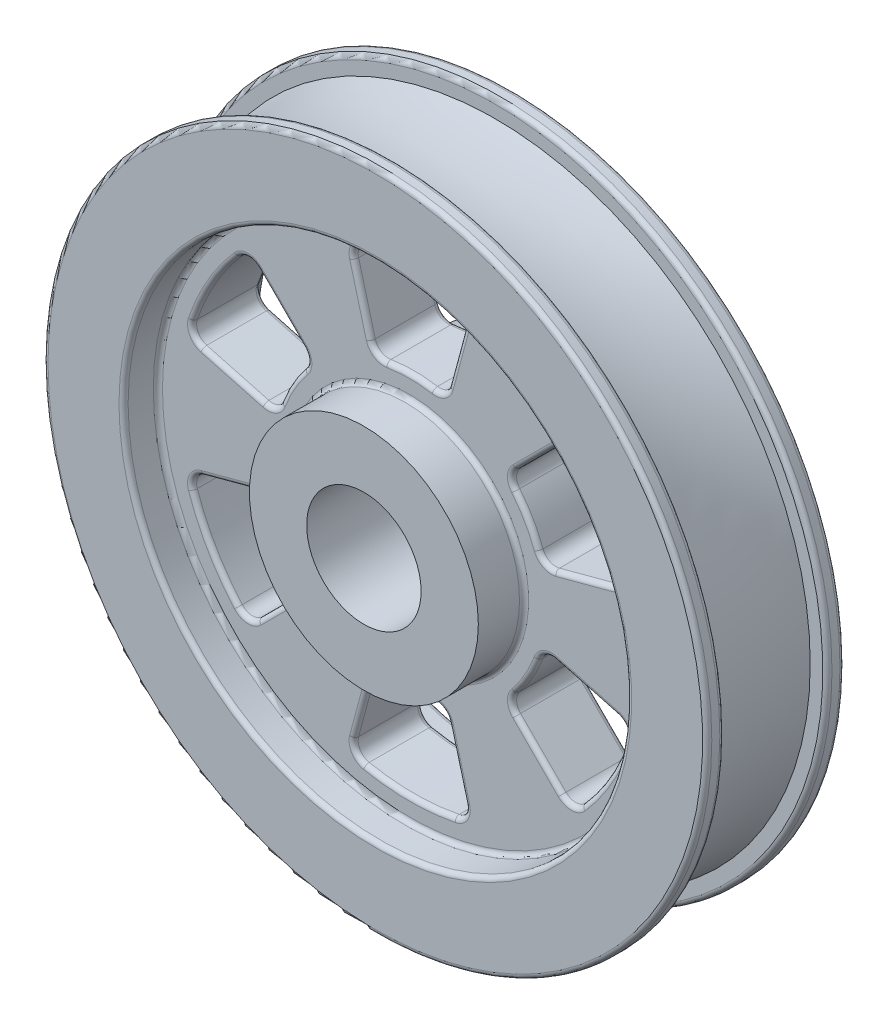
SolidWorks part; units mm, degrees
ref_plane "Front Plane" through (0, 0, 0) normal (0, 0, 1) x (1, 0, 0)
ref_plane "Top Plane" through (0, 0, 0) normal (0, 1, 0) x (1, 0, 0)
ref_plane "Right Plane" through (0, 0, 0) normal (1, 0, 0) x (0, 0, -1)
sketch "Wheel Cross-section" plane through (0, 0, 0) normal (1, 0, 0) x (0, 0, -1)
  line L0 (-130.7747, 0) -> (134.6553, 0) construction
  line L1 (44.45, 31.75) -> (44.45, 63.5)
  line L2 (44.45, 63.5) -> (19.05, 63.5)
  line L3 (19.05, 63.5) -> (19.05, 139.7)
  line L4 (19.05, 139.7) -> (38.1, 139.7)
  line L5 (38.1, 139.7) -> (38.1, 184.15)
  line L6 (38.1, 184.15) -> (28.575, 184.15)
  line L7 (28.575, 184.15) -> (28.575, 174.625)
  line L9 (-28.575, 174.625) -> (-28.575, 184.15)
  line L10 (-28.575, 184.15) -> (-38.1, 184.15)
  line L11 (-38.1, 184.15) -> (-38.1, 139.7)
  line L12 (-38.1, 139.7) -> (-19.05, 139.7)
  line L13 (-19.05, 139.7) -> (-19.05, 63.5)
  line L14 (-19.05, 63.5) -> (-44.45, 63.5)
  line L15 (-44.45, 63.5) -> (-44.45, 31.75)
  line L17 (-44.45, 31.75) -> (44.45, 31.75)
  arc A0 (28.575, 174.625) -> (-28.575, 174.625) centre (0, 324.3221) cw
  dimension "D13" = 152.4
  dimension "D14" = 9.525
  dimension "D1" = 44.45
  dimension "D2" = 88.9
  dimension "D3" = 25.4
  dimension "D4" = 38.1
  dimension "D5" = 63.5
  dimension "D6" = 76.2
  dimension "D7" = 9.525
  dimension "D8" = 9.525
  dimension "D9" = 31.75
  dimension "D10" = 6.35
  dimension "D11" = 139.7
  dimension "D12" = 184.15
revolve "Revolve1" add sketch "Wheel Cross-section" angle 360 about L0
sketch "Spoke cut-out" plane through (0, 0, 19.05) normal (0, 0, 1) x (1, 0, 0)
  line L0 (0, 0) -> (-60.1063, 224.3199) construction
  line L1 (0, 0) -> (0, 216.2459) construction
  line L2 (0, 0) -> (59.3665, 221.5588) construction
  line L3 (30.8348, 115.0771) -> (21.6044, 80.6286)
  line L4 (-30.8348, 115.0771) -> (-21.6044, 80.6286)
  circle A0 centre (0, 0) radius 127 construction
  circle A1 centre (0, 0) radius 76.2 construction
  arc A2 (24.9728, 124.5205) -> (-24.9728, 124.5205) centre (0, 0) ccw
  arc A3 (12.9491, 75.0917) -> (-12.9491, 75.0917) centre (0, 0) ccw
  arc A4 (24.9728, 124.5205) -> (30.8348, 115.0771) centre (23.4745, 117.0493) cw
  arc A5 (-24.9728, 124.5205) -> (-30.8348, 115.0771) centre (-23.4745, 117.0493) ccw
  arc A6 (-12.9491, 75.0917) -> (-21.6044, 80.6286) centre (-14.244, 82.6008) cw
  arc A7 (12.9491, 75.0917) -> (21.6044, 80.6286) centre (14.244, 82.6008) ccw
  point P13 (32.87, 122.6726)
  point P16 (-32.87, 122.6726)
  point P19 (-19.722, 73.6035)
  point P22 (19.722, 73.6035)
  dimension "D1" = 254
  dimension "D2" = 152.4
  dimension "D5" = 7.62
  dimension "D6" = 7.62
  dimension "D7" = 7.62
  dimension "D3" = 15
  dimension "D4" = 15
extrude "Spoke hole" cut sketch "Spoke cut-out" against normal through all
pattern_circular "Spoke hole pattern" count 6 over 360 about axis through (0, 0, 0) along (0, 0, 1) of "Spoke hole"
fillet "0.10 inch Fillets & Rounds" radius 2.54 106 edges at (184.15, 0, -38.1) (-119.8223, -34.5978, 19.05) (-109.9852, -63.5, 19.05) (-89.8737, -86.4702, 19.05) (-71.6333, -71.6333, 19.05) (-56.8003, -53.9828, 19.05) (-65.9911, -38.1, 19.05) (-75.1507, -22.1991, 19.05) (-97.8529, -26.2196, 19.05) (184.15, 0, -28.575) (184.15, 0, 28.575) (0, -127, -19.05) (29.9485, -121.0681, -19.05) (26.2196, -97.8529, -19.05) (18.3504, -76.1819, -19.05) (0, -76.2, -19.05) (-18.3504, -76.1819, -19.05) (-26.2196, -97.8529, -19.05) (-29.9485, -121.0681, -19.05) (184.15, 0, 38.1) (139.7, 0, 38.1) (-29.9485, -121.0681, 19.05) (0, -127, 19.05) (29.9485, -121.0681, 19.05) (26.2196, -97.8529, 19.05) (18.3504, -76.1819, 19.05) (0, -76.2, 19.05) (-18.3504, -76.1819, 19.05) (-26.2196, -97.8529, 19.05) (139.7, 0, 19.05) (63.5, 0, 19.05) (109.9852, -63.5, -19.05) (119.8223, -34.5978, -19.05) (97.8529, -26.2196, -19.05) (75.1507, -22.1991, -19.05) (65.9911, -38.1, -19.05) (56.8003, -53.9828, -19.05) (71.6333, -71.6333, -19.05) (89.8737, -86.4702, -19.05) (89.8737, -86.4702, 19.05) (109.9852, -63.5, 19.05) (119.8223, -34.5978, 19.05) (97.8529, -26.2196, 19.05) (75.1507, -22.1991, 19.05) (65.9911, -38.1, 19.05) (56.8003, -53.9828, 19.05) (71.6333, -71.6333, 19.05) (109.9852, 63.5, -19.05) (89.8737, 86.4702, -19.05) (71.6333, 71.6333, -19.05) (56.8003, 53.9828, -19.05) (65.9911, 38.1, -19.05) (75.1507, 22.1991, -19.05) (97.8529, 26.2196, -19.05) (119.8223, 34.5978, -19.05) (119.8223, 34.5978, 19.05) (109.9852, 63.5, 19.05) (89.8737, 86.4702, 19.05) (71.6333, 71.6333, 19.05) (56.8003, 53.9828, 19.05) (65.9911, 38.1, 19.05) (75.1507, 22.1991, 19.05) (97.8529, 26.2196, 19.05) (0, 127, -19.05) (-29.9485, 121.0681, -19.05) (-26.2196, 97.8529, -19.05) (-18.3504, 76.1819, -19.05) (0, 76.2, -19.05) (18.3504, 76.1819, -19.05) (26.2196, 97.8529, -19.05) (29.9485, 121.0681, -19.05) (29.9485, 121.0681, 19.05) (0, 127, 19.05) (-29.9485, 121.0681, 19.05) (-26.2196, 97.8529, 19.05) (-18.3504, 76.1819, 19.05) (0, 76.2, 19.05) (18.3504, 76.1819, 19.05) (26.2196, 97.8529, 19.05) (-109.9852, 63.5, -19.05) (-119.8223, 34.5978, -19.05) (-97.8529, 26.2196, -19.05) (-75.1507, 22.1991, -19.05) (-65.9911, 38.1, -19.05) (-56.8003, 53.9828, -19.05) (-71.6333, 71.6333, -19.05) (-89.8737, 86.4702, -19.05) (-89.8737, 86.4702, 19.05) (-109.9852, 63.5, 19.05) (-119.8223, 34.5978, 19.05) (-97.8529, 26.2196, 19.05) (-75.1507, 22.1991, 19.05) (-65.9911, 38.1, 19.05) (-56.8003, 53.9828, 19.05) (-71.6333, 71.6333, 19.05) (63.5, 0, -19.05) (139.7, 0, -19.05) (-109.9852, -63.5, -19.05) (-89.8737, -86.4702, -19.05) (-71.6333, -71.6333, -19.05) (-56.8003, -53.9828, -19.05) (-65.9911, -38.1, -19.05) (-75.1507, -22.1991, -19.05) (-97.8529, -26.2196, -19.05) (-119.8223, -34.5978, -19.05) (139.7, 0, -38.1)
